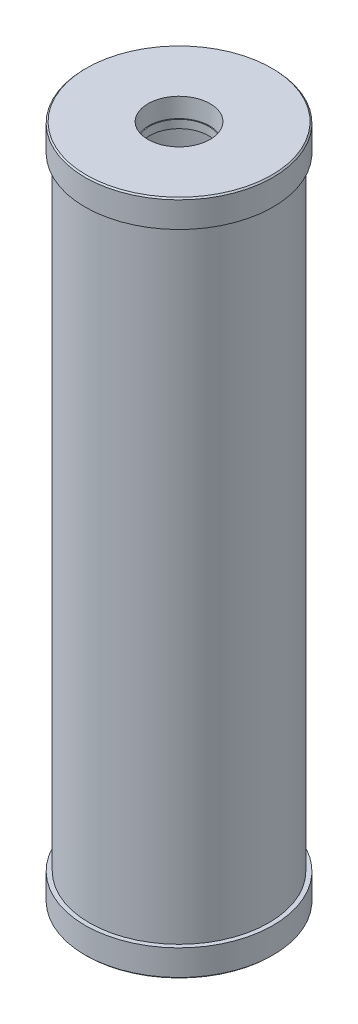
SolidWorks part; units mm, degrees
ref_plane "Front Plane" through (0, 0, 0) normal (0, 0, 1) x (1, 0, 0)
ref_plane "Top Plane" through (0, 0, 0) normal (0, 1, 0) x (1, 0, 0)
ref_plane "Right Plane" through (0, 0, 0) normal (1, 0, 0) x (0, 0, -1)
sketch "Sketch1" plane through (0, 0, 0) normal (0, 1, 0) x (1, 0, 0)
  circle A0 centre (0, 0) radius 84.201
  circle A1 centre (0, 0) radius 74.676
  dimension "D1" = 168.402
  dimension "D2" = 9.525
extrude "Boss-Extrude1" add sketch "Sketch1" along normal blind 635
ref_plane "Plane1" through (0, 635, 0) normal (0, 1, 0) x (1, 0, 0)
sketch "Sketch2" plane through (0, 0, 0) normal (0, 1, 0) x (1, 0, 0)
  circle A0 centre (0, 0) radius 88.265
  dimension "D1" = 176.53
extrude "Boss-Extrude2" add sketch "Sketch2" along normal blind 25.4
sketch "Sketch3" plane through (0, 635, 0) normal (0, 1, 0) x (1, 0, 0)
  circle A0 centre (0, 0) radius 88.265
  dimension "D1" = 176.53
extrude "Boss-Extrude3" add sketch "Sketch3" against normal blind 25.4
hole_wizard "2 NPT Tapped Hole1" positions "Sketch5" profile "Sketch4" size "2" standard "ANSI Inch"
sketch "Sketch5" plane through (0, 635, 0) normal (0, 1, 0) x (1, 0, 0)
  point P0 (0, 0)
sketch "Sketch4" plane through (0, 635, 0) normal (1, 0, 0) x (0, 0, 1)
  line L0 (0, 0) -> (0, 45.6525)
  line L1 (27.7876, 28.956) -> (0, 45.6525)
  line L2 (-27.7876, 28.956) -> (0, 45.6525) construction
  line L3 (27.7876, 28.956) -> (27.7876, 17.78)
  line L4 (27.7876, 17.78) -> (28.6326, 17.78)
  line L5 (28.6326, 17.78) -> (29.165, 0)
  line L6 (-28.6326, 17.78) -> (-29.165, 0) construction
  line L7 (29.165, 0) -> (0, 0)
  line L8 (0, -6.35) -> (0, 107.95) construction
  line L11 (-27.7876, 17.78) -> (-28.6326, 17.78) construction
  dimension "Tap Drill Dia." = 55.5752
  dimension "Tap Drill Depth" = 28.956
  dimension "Thread Dia." = 58.33
  dimension "Thread Angle" = 3.43
  dimension "Thread Depth" = 17.78
  dimension "Drill Angle" = 118
hole_wizard "2 NPT Tapped Hole3" positions "Sketch11" profile "Sketch10" size "2" standard "ANSI Inch"
sketch "Sketch11" plane through (0, 0, 0) normal (0, 1, 0) x (1, 0, 0)
  point P0 (0, 0)
sketch "Sketch10" plane through (0, 0, 0) normal (1, 0, 0) x (0, 0, -1)
  line L0 (0, 0) -> (0, 45.6525)
  line L1 (27.7876, 28.956) -> (0, 45.6525)
  line L2 (-27.7876, 28.956) -> (0, 45.6525) construction
  line L3 (27.7876, 28.956) -> (27.7876, 17.78)
  line L4 (27.7876, 17.78) -> (28.6326, 17.78)
  line L5 (28.6326, 17.78) -> (29.165, 0)
  line L6 (-28.6326, 17.78) -> (-29.165, 0) construction
  line L7 (29.165, 0) -> (0, 0)
  line L8 (0, -6.35) -> (0, 107.95) construction
  line L11 (-27.7876, 17.78) -> (-28.6326, 17.78) construction
  dimension "Tap Drill Dia." = 55.5752
  dimension "Tap Drill Depth" = 28.956
  dimension "Thread Dia." = 58.33
  dimension "Thread Angle" = 3.43
  dimension "Thread Depth" = 17.78
  dimension "Drill Angle" = 118
chamfer "Chamfer1" distance 1.27 angle 45 2 edges at (0, 0, 88.265) (0, 635, 88.265)
